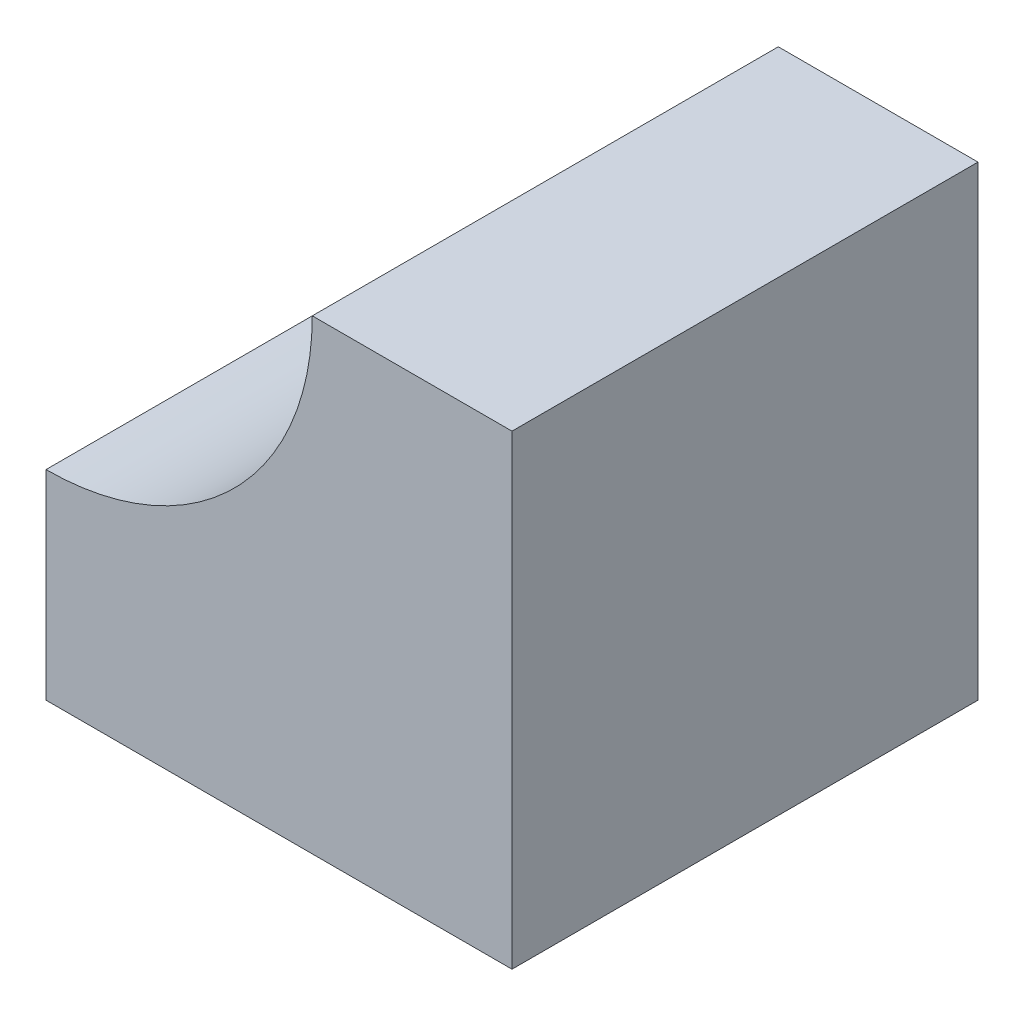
SolidWorks part; units mm, degrees
ref_plane "Front Plane" through (0, 0, 0) normal (0, 0, 1) x (1, 0, 0)
ref_plane "Top Plane" through (0, 0, 0) normal (0, 1, 0) x (1, 0, 0)
ref_plane "Right Plane" through (0, 0, 0) normal (1, 0, 0) x (0, 0, -1)
sketch "Sketch1" plane through (0, 0, 0) normal (0, 0, 1) x (1, 0, 0)
  line L1 (-44.45, 44.45) -> (44.45, 44.45)
  line L2 (-44.45, 44.45) -> (-44.45, -44.45)
  line L3 (-44.45, -44.45) -> (44.45, -44.45)
  line L4 (44.45, 44.45) -> (44.45, -44.45)
  line L5 (-44.45, 44.45) -> (44.45, -44.45) construction
  line L6 (-44.45, -44.45) -> (44.45, 44.45) construction
  arc A0 (-44.45, -6.35) -> (6.35, 44.45) centre (-44.45, 44.45) ccw
  point P0 (0, 0)
  point P9 (0, 0)
  point P10 (-55.4823, 55.4823)
  point P11 (0, 0)
  dimension "D1" = 88.9
  dimension "D2" = 88.9
  dimension "D3" = 50.8
  dimension "D4" = 50.8
extrude "Boss-Extrude1" add sketch "Sketch1" along normal blind 88.9
